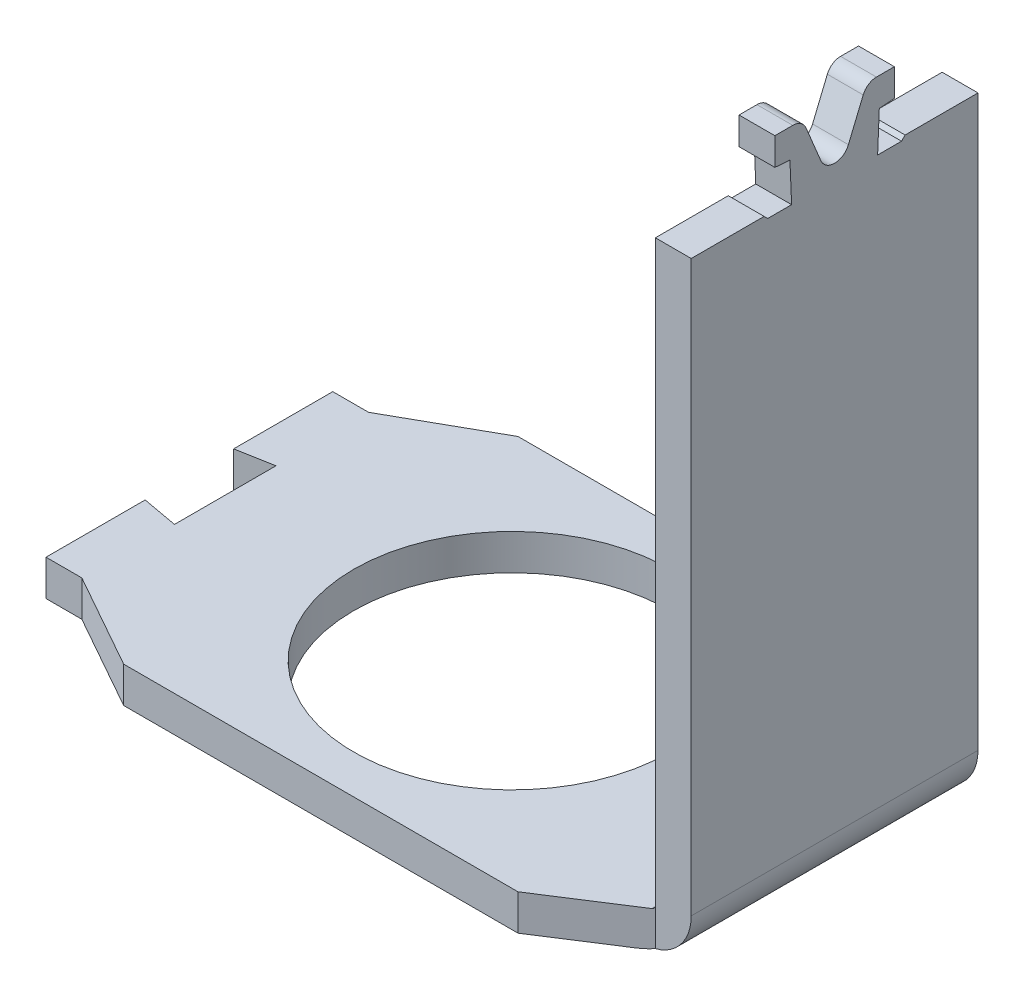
SolidWorks part; units mm, degrees
ref_plane "Plan de face" through (0, 0, 0) normal (0, 0, 1) x (1, 0, 0)
ref_plane "Plan de dessus" through (0, 0, 0) normal (0, 1, 0) x (1, 0, 0)
ref_plane "Plan de droite" through (0, 0, 0) normal (1, 0, 0) x (0, 0, -1)
sketch "Esquisse1" plane through (0, 0, 0) normal (0, 0, 1) x (1, 0, 0)
  line L1 (-4, 0) -> (-54, 0)
  line L3 (-3.2, 3) -> (-54, 3)
  line L4 (-54, 0) -> (-54, 3)
  line L6 (0, 4) -> (0, 57.05)
  line L7 (0, 57.05) -> (-3, 57.05)
  line L8 (-3, 3.2) -> (-3, 57.05)
  arc A0 (-4, 0) -> (0, 4) centre (-4, 4) ccw
  arc A1 (-3.2, 3) -> (-3, 3.2) centre (-3.2, 3.2) ccw
  point P9 (0, 0)
  dimension "D3" = 4
  dimension "D4" = 0.2
  dimension "D1" = 3
  dimension "D2" = 3
  dimension "D5" = 3
  dimension "D6" = 3
  dimension "D7" = 57.05
  dimension "D8" = 54
extrude "Extrusion1" add sketch "Esquisse1" along normal mid plane 33
sketch "Esquisse2" plane through (0, 3, 0) normal (0, 1, 0) x (-1, 0, 0)
  line L0 (3, -12) -> (10, -16.5)
  line L1 (3.2, 16.5) -> (54, 16.5) construction
  line L2 (10, 16.5) -> (43, 16.5)
  line L3 (43, 16.5) -> (51, 12)
  line L4 (51, 12) -> (57, 12)
  line L5 (57, 12) -> (57, 3.7)
  line L6 (57, 3.7) -> (54, 3.7)
  line L7 (54, 16.5) -> (54, -16.5) construction
  line L8 (51, -4.25) -> (51, 4.25)
  line L9 (51, 4.25) -> (54, 3.7)
  line L10 (0, 0) -> (56.3459, 0) construction
  line L11 (0, 12) -> (0, -12)
  line L12 (0, 16.5) -> (0, -16.5) construction
  line L13 (0, 12) -> (3, 12)
  line L14 (3, 16.5) -> (3, -16.5) construction
  line L15 (3, 12) -> (10, 16.5)
  line L16 (0, -12) -> (3, -12)
  line L18 (51, -4.25) -> (54, -3.7)
  line L19 (57, -3.7) -> (54, -3.7)
  line L20 (57, -12) -> (57, -3.7)
  line L21 (51, -12) -> (57, -12)
  line L22 (43, -16.5) -> (51, -12)
  line L23 (10, -16.5) -> (43, -16.5)
  circle A0 centre (27, 0) radius 13.25
  point P18 (13.75, 0)
  point P28 (51, 0)
  point P34 (40.25, 0)
  dimension "D9" = 26.5
  dimension "D4" = 30
  dimension "D1" = 33
  dimension "D2" = 11
  dimension "D3" = 12
  dimension "D5" = 8.3
  dimension "D6" = 4.25
  dimension "D7" = 27
  dimension "D8" = 12
  dimension "D10" = 3
  dimension "D11" = 3
extrude "Enlèv. mat.-Extru.1" cut sketch "Esquisse2" along normal through all and the other way blind 33 flip side to cut
sketch "Esquisse3" plane through (-3, 0, 0) normal (-1, 0, 0) x (0, 0, 1)
  line L0 (12, 57.05) -> (-12, 57.05) construction
  line L1 (3.6, 51.35) -> (3.7383, 54.65)
  line L2 (-3.5, 57.05) -> (-3.5, 58.55)
  line L3 (3.6, 51.35) -> (5.6, 51.35)
  line L4 (5.6, 51.35) -> (5.9, 51.65)
  line L5 (5.9, 51.65) -> (13.2, 51.65)
  line L6 (13.2, 51.65) -> (13.2, 57.05)
  line L7 (13.2, 57.05) -> (5, 57.05)
  line L8 (-1.155, 53.322) -> (-2.3912, 56.3089)
  line L9 (0, 59.7219) -> (0, 50.9071) construction
  line L10 (3.7383, 54.65) -> (5, 54.75)
  line L11 (-5, 54.75) -> (-5, 57.05)
  line L12 (-3.7383, 54.65) -> (-5, 54.75)
  line L13 (-13.2, 57.05) -> (-5, 57.05)
  line L14 (-13.2, 51.65) -> (-13.2, 57.05)
  line L15 (-5.9, 51.65) -> (-13.2, 51.65)
  line L16 (-5.6, 51.35) -> (-5.9, 51.65)
  line L17 (-3.6, 51.35) -> (-5.6, 51.35)
  line L18 (-3.6, 51.35) -> (-3.7383, 54.65)
  line L21 (5, 54.75) -> (5, 57.05)
  line L23 (1.155, 53.322) -> (2.3912, 56.3089)
  line L24 (3.5, 57.05) -> (3.5, 58.55)
  line L25 (3.5, 58.55) -> (-3.5, 58.55)
  arc A0 (-1.155, 53.322) -> (1.155, 53.322) centre (0, 53.8) ccw
  arc A1 (3.5, 57.05) -> (2.3912, 56.3089) centre (3.5, 55.85) ccw
  arc A2 (-3.5, 57.05) -> (-2.3912, 56.3089) centre (-3.5, 55.85) cw
  point P2 (0, 52.55)
  point P20 (0, 58.55)
  point P27 (0, 58.5861)
  dimension "D1" = 2.5
  dimension "D15" = 1.2
  dimension "D2" = 4.5
  dimension "D3" = 3.6
  dimension "D4" = 1.5
  dimension "D5" = 2.3
  dimension "D6" = 2.4
  dimension "D7" = 1.2617
  dimension "D8" = 2
  dimension "D9" = 135
  dimension "D10" = 2.4
  dimension "D11" = 3.5
  dimension "D12" = 5
  dimension "D13" = 13.2
  dimension "D14" = 5.4
extrude "Enlèv. mat.-Extru.2" cut sketch "Esquisse3" against normal through all
